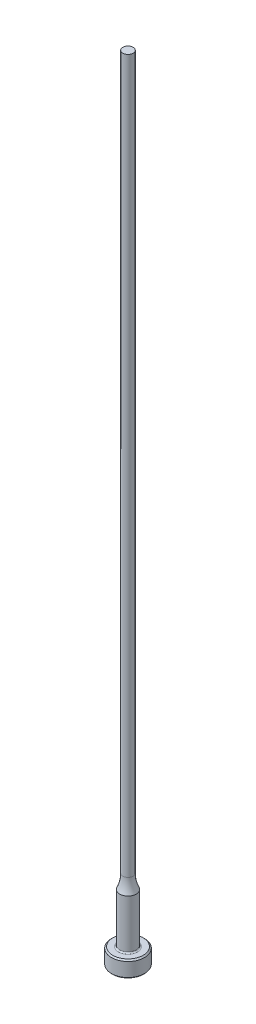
SolidWorks part; units mm, degrees
ref_plane "Front Plane" through (0, 0, 0) normal (0, 0, 1) x (1, 0, 0)
ref_plane "Top Plane" through (0, 0, 0) normal (0, 1, 0) x (1, 0, 0)
ref_plane "Right Plane" through (0, 0, 0) normal (1, 0, 0) x (0, 0, -1)
sketch "Sketch1" plane through (0, 0, 0) normal (0, 0, 1) x (1, 0, 0)
  line L0 (0, 259.9588) -> (0, -15.1925) construction
  line L1 (0, 0) -> (-3.175, 0)
  line L2 (-3.175, 0) -> (-3.175, 3.175)
  line L3 (-3.175, 3.175) -> (-1.5875, 3.175)
  line L4 (-0.9919, 15.3851) -> (-0.9919, 152.4)
  line L5 (-0.9919, 152.4) -> (0, 152.4)
  line L6 (0, 152.4) -> (0, 0)
  line L7 (-1.5875, 3.175) -> (-1.5875, 12.7)
  arc A0 (-1.5875, 12.7) -> (-0.9919, 15.3851) centre (-7.3419, 15.3851) ccw
  point P13 (-1.5875, 0)
  dimension "D1" = 6.35
  dimension "L" = 152.4
  dimension "D2" = 3.175
  dimension "H" = 6.35
  dimension "T" = 3.175
  dimension "D" = 1.9837
  dimension "S" = 12.7
revolve "Revolve1" add sketch "Sketch1" angle 360 about L0
chamfer "Chamfer1" distance 0.254 angle 45 2 edges at (0, 3.175, 3.175) (0, 0, 3.175)
fillet "Fillet1" radius 0.254 1 edges at (0, 3.175, 1.5875)
